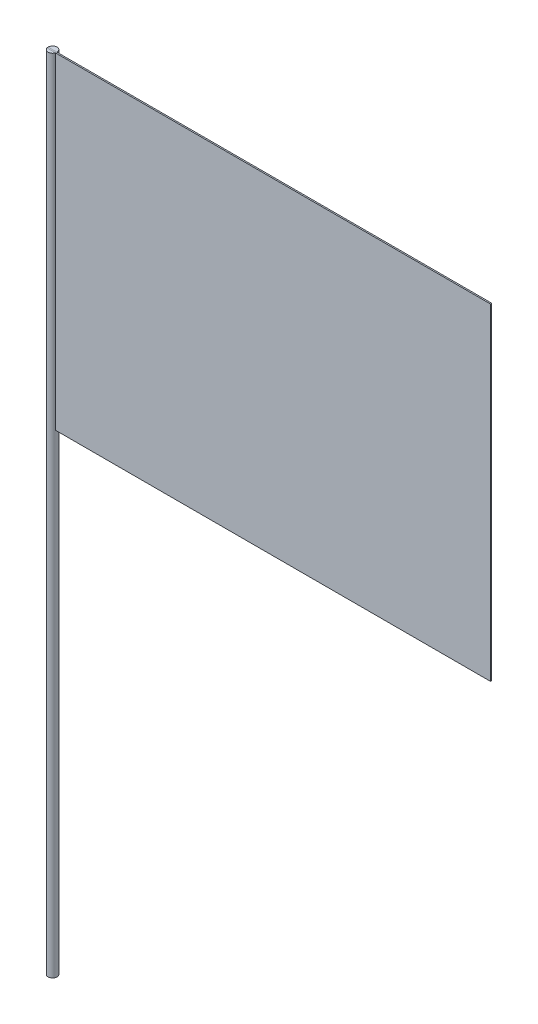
SolidWorks part; units mm, degrees
ref_plane "Front Plane" through (0, 0, 0) normal (0, 0, 1) x (1, 0, 0)
ref_plane "Top Plane" through (0, 0, 0) normal (0, 1, 0) x (1, 0, 0)
ref_plane "Right Plane" through (0, 0, 0) normal (1, 0, 0) x (0, 0, -1)
sketch "Sketch1" plane through (0, 0, 0) normal (0, 1, 0) x (1, 0, 0)
  circle A0 centre (0, 0) radius 5.08
extrude "Extrude1" add sketch "Sketch1" along normal blind 914.4
sketch "Sketch2" plane through (0, 0, 0) normal (0, 0, 1) x (1, 0, 0)
  line L1 (-5.08, 914.4) -> (501.4803, 914.4)
  line L2 (-5.08, 914.4) -> (-5.08, 541.247)
  line L3 (-5.08, 541.247) -> (501.4803, 541.247)
  line L4 (501.4803, 914.4) -> (501.4803, 541.247)
extrude "Extrude2" add sketch "Sketch2" along normal blind 1.524 separate body
